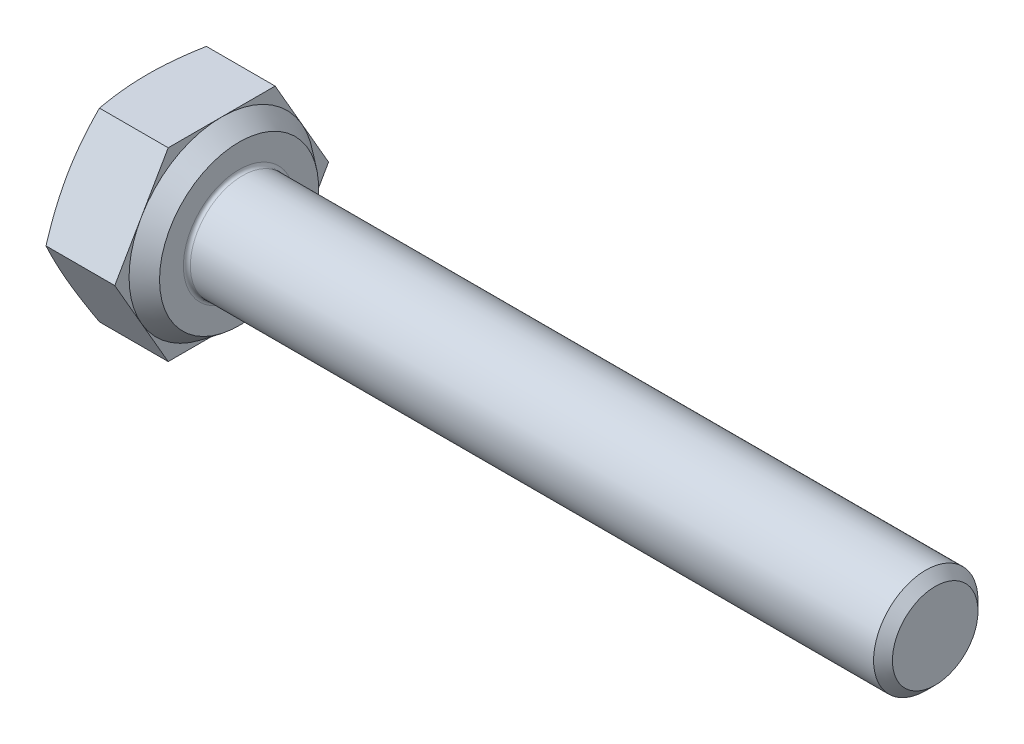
SolidWorks part; units mm, degrees
ref_plane "Front" through (0, 0, 0) normal (0, 0, 1) x (1, 0, 0)
ref_plane "Top" through (0, 0, 0) normal (0, 1, 0) x (1, 0, 0)
ref_plane "Right" through (0, 0, 0) normal (1, 0, 0) x (0, 0, -1)
sketch "Sketch-BaseHead" plane through (0, 0, 0) normal (1, 0, 0) x (0, 0, -1)
  line L1 (3.0715, 0) -> (1.5358, 2.66)
  line L2 (1.5358, 2.66) -> (-1.5358, 2.66)
  line L3 (-1.5358, 2.66) -> (-3.0715, 0)
  line L4 (-3.0715, 0) -> (-1.5358, -2.66)
  line L5 (-1.5358, -2.66) -> (1.5358, -2.66)
  line L6 (1.5358, -2.66) -> (3.0715, 0)
  circle A0 centre (0, 0) radius 2.66 construction
  dimension "s" = 5.32
extrude "BaseHead" add sketch "Sketch-BaseHead" along normal blind 2.125
sketch "Sketch4" plane through (-0.2646, 0, 5.9169) normal (0, 1, 0) x (0, 0, -1)
  line L0 (5.9169, 3.7369) -> (5.9169, -10.4477) construction
  line L2 (8.9884, -0.2646) -> (8.5769, -0.2646)
  line L4 (8.5769, -0.2646) -> (8.9884, -0.4144)
  line L6 (8.9884, -0.4144) -> (8.9884, -0.2646)
  dimension "D1" = 20
  dimension "D2" = 5.32
revolve "HeadChamfer" cut sketch "Sketch4" angle 360 about L0
sketch "Sketch1" plane through (0, 0, 0) normal (0, 0, 1) x (1, 0, 0)
  line L0 (2.125, 0) -> (2.625, 0)
  line L1 (2.625, 0) -> (2.625, -2.285)
  line L2 (2.625, -2.285) -> (2.125, -2.66)
  line L3 (2.125, -2.66) -> (2.125, 0) construction
  line L4 (0, 0) -> (7.5821, 0) construction
  line L5 (-4.0016, 0) -> (10.1831, 0) construction
  line L6 (2.125, -2.66) -> (0.1498, -2.66) construction
  line L7 (2.125, 0) -> (2.125, -2.66)
  dimension "D1" = 2.66
  dimension "c" = 0.5
  dimension "D2" = 2.285
revolve "Revolve1" add sketch "Sketch1" angle 360 about axis through (-4.0016, 0, 0) along (1, 0, 0)
ref_plane "Plane2" through (10.625, 0, 0) normal (1, 0, 0) x (0, 0, -1)
sketch "Sketch3" plane through (2.625, 0, 0) normal (1, 0, 0) x (0, 0, -1)
  circle A0 centre (0, 0) radius 1.5
  dimension "d" = 3
extrude "BaseBody" add sketch "Sketch3" along normal blind 20
fillet "HeadFillet" radius 0.1 1 edges at (2.625, 0, -1.5)
chamfer "Chamfer1" distance 0.2705 angle 45 1 edges at (22.625, 0, -1.5)
equation "\"D1@Sketch1\" = \"s@Sketch-BaseHead\"/ 2"
equation "\"D2@Sketch4\" = \"s@Sketch-BaseHead\""
equation "\"D1@Chamfer1\" =  ( \"d@Sketch3\" - \"D2@ThreadCosmetic1\" ) / 2 "
equation "\"b@ThreadCosmetic1\" = \"l@BaseBody\" - \"lg@Plane2\""
